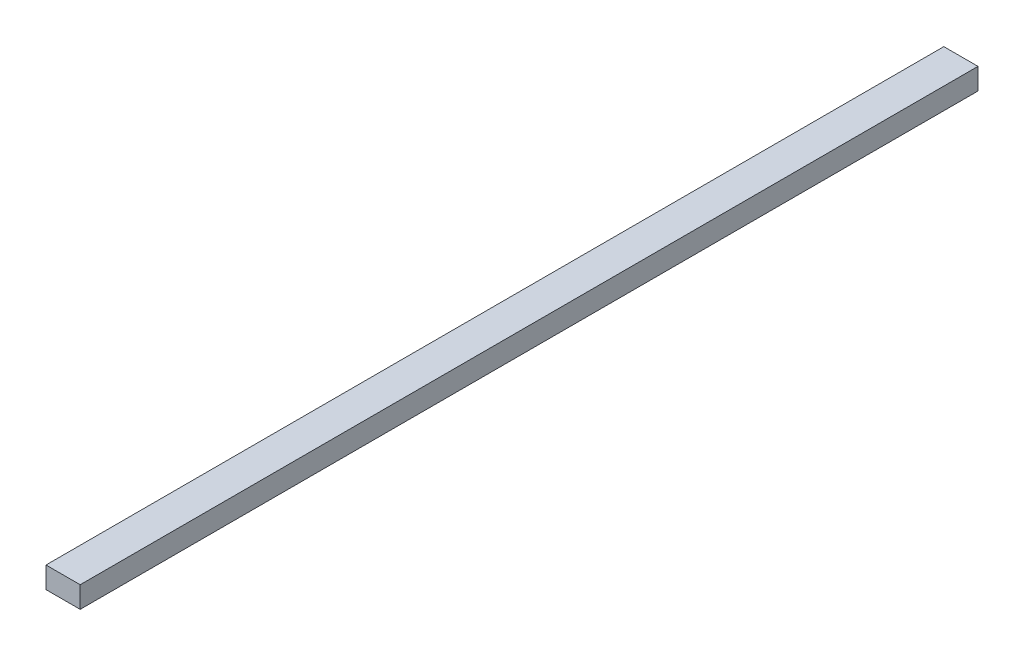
SolidWorks part; units mm, degrees
ref_plane "Front Plane" through (0, 0, 0) normal (0, 0, 1) x (1, 0, 0)
ref_plane "Top Plane" through (0, 0, 0) normal (0, 1, 0) x (1, 0, 0)
ref_plane "Right Plane" through (0, 0, 0) normal (1, 0, 0) x (0, 0, -1)
sketch "Sketch1" plane through (0, 0, 0) normal (0, 0, 1) x (1, 0, 0)
  line L1 (-41.0796, 12.5143) -> (-15.6796, 12.5143)
  line L2 (-41.0796, 12.5143) -> (-41.0796, -3.3607)
  line L3 (-41.0796, -3.3607) -> (-15.6796, -3.3607)
  line L4 (-15.6796, 12.5143) -> (-15.6796, -3.3607)
  dimension "D1" = 25.4
  dimension "D2" = 15.875
extrude "Boss-Extrude1" add sketch "Sketch1" along normal blind 667.4002
